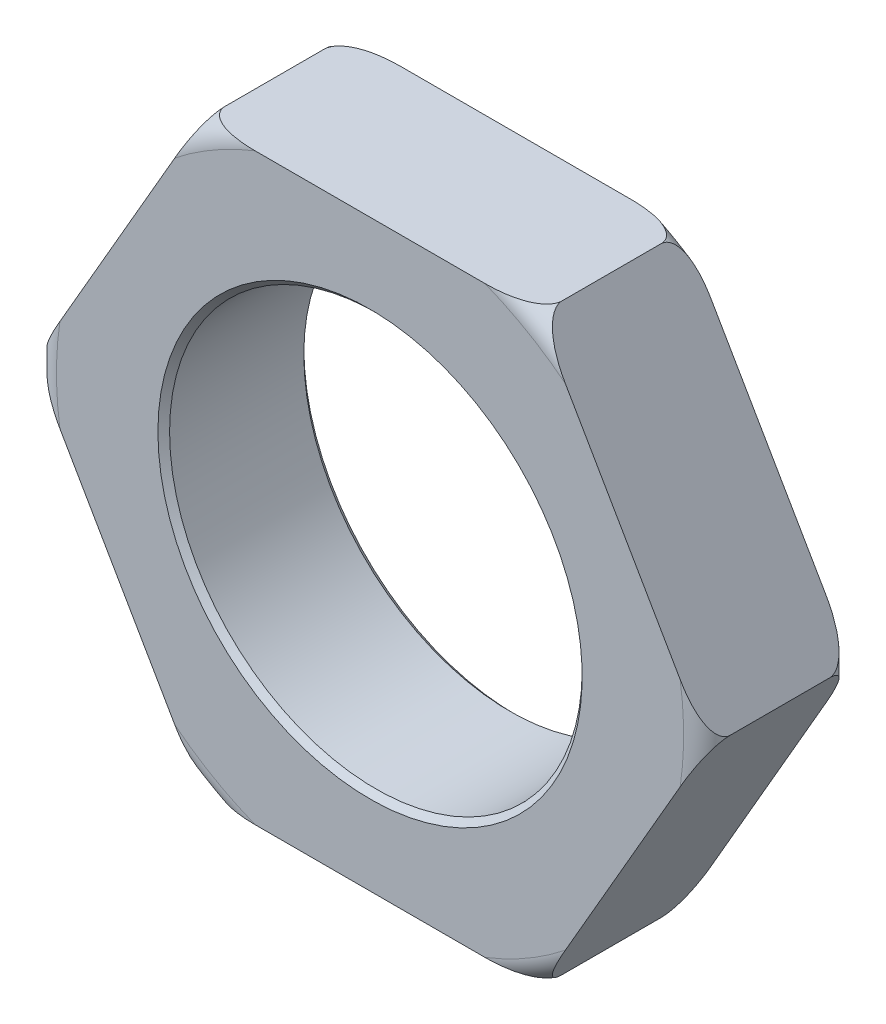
SolidWorks part; units mm, degrees
ref_plane "Front" through (0, 0, 0) normal (0, 0, 1) x (1, 0, 0)
ref_plane "Top" through (0, 0, 0) normal (0, 1, 0) x (1, 0, 0)
ref_plane "Right" through (0, 0, 0) normal (1, 0, 0) x (0, 0, -1)
sketch "Sketch1" plane through (0, 0, 0) normal (0, 0, 1) x (1, 0, 0)
  line L1 (14.6647, 0) -> (7.3323, 12.7)
  line L2 (7.3323, 12.7) -> (-7.3323, 12.7)
  line L3 (-7.3323, 12.7) -> (-14.6647, 0)
  line L4 (-14.6647, 0) -> (-7.3323, -12.7)
  line L5 (-7.3323, -12.7) -> (7.3323, -12.7)
  line L6 (7.3323, -12.7) -> (14.6647, 0)
  circle A0 centre (0, 0) radius 12.7 construction
extrude "Base-Extrude" add sketch "Sketch1" against normal blind 6.35
sketch "Sketch3" plane through (0, 0, 0) normal (0, 0, 1) x (1, 0, 0)
  circle A0 centre (0, 0) radius 8.9789
  dimension "D1" = 17.9578
extrude "Cut-Extrude1" cut sketch "Sketch3" against normal through all
chamfer "Chamfer1" distance 0.254 angle 45
sketch "Sketch4" plane through (0, 0, 0) normal (0, 1, 0) x (1, 0, 0)
  line L0 (-14.6647, 6.35) -> (-14.6647, 0) construction
  line L1 (-14.6647, 5.334) -> (-14.6647, 1.016)
  line L2 (-7.3323, 6.35) -> (-14.6647, 6.35) construction
  line L3 (-7.3323, 6.35) -> (-13.6487, 6.35)
  line L4 (-7.3323, 0) -> (-14.6647, 0) construction
  line L5 (-7.3323, 0) -> (-13.6487, 0)
  line L6 (-7.3323, 6.35) -> (-7.3323, 9.5402)
  line L7 (-7.3323, 9.5402) -> (-16.1168, 9.5402)
  line L8 (-16.1168, 9.5402) -> (-16.1168, -2.481)
  line L9 (-16.1168, -2.481) -> (-7.3323, -2.481)
  line L10 (-7.3323, -2.481) -> (-7.3323, 0)
  line L11 (0, 10.7682) -> (0, -4.4533) construction
  line L12 (0, 6.096) -> (0, 0.254) construction
  arc A0 (-14.6647, 5.334) -> (-13.6487, 6.35) centre (-13.6487, 5.334) cw
  arc A1 (-13.6487, 0) -> (-14.6647, 1.016) centre (-13.6487, 1.016) cw
  dimension "D1" = 1.016
  dimension "D2" = 1.016
revolve "Cut-Revolve1" cut sketch "Sketch4" angle 360 about L11
